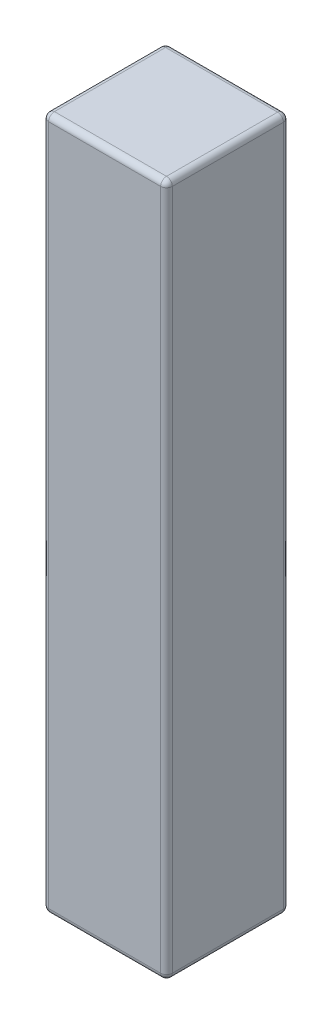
SolidWorks part; units mm, degrees
ref_plane "Front Plane" through (0, 0, 0) normal (0, 0, 1) x (1, 0, 0)
ref_plane "Top Plane" through (0, 0, 0) normal (0, 1, 0) x (1, 0, 0)
ref_plane "Right Plane" through (0, 0, 0) normal (1, 0, 0) x (0, 0, -1)
sketch "Sketch1" plane through (0, 0, 0) normal (0, 1, 0) x (1, 0, 0)
  line L1 (-1.5875, 1.5748) -> (1.5875, 1.5748)
  line L2 (-1.5875, 1.5748) -> (-1.5875, -1.5748)
  line L3 (-1.5875, -1.5748) -> (1.5875, -1.5748)
  line L4 (1.5875, 1.5748) -> (1.5875, -1.5748)
  line L8 (0, 0) -> (1.5875, 0) construction
  line L9 (0, 0) -> (0, 1.5748) construction
  dimension "D1" = 3.175
  dimension "D2" = 3.1496
extrude "Extrude1" add sketch "Sketch1" along normal blind 17.78
fillet "Fillet1" radius 0.15 12 edges at (0, 0, 1.5748) (1.5875, 8.89, 1.5748) (1.5875, 0, 0) (-1.5875, 8.89, 1.5748) (-1.5875, 0, 0) (1.5875, 17.78, 0) (0, 17.78, 1.5748) (-1.5875, 17.78, 0) (1.5875, 8.89, -1.5748) (0, 17.78, -1.5748) (-1.5875, 8.89, -1.5748) (0, 0, -1.5748)
